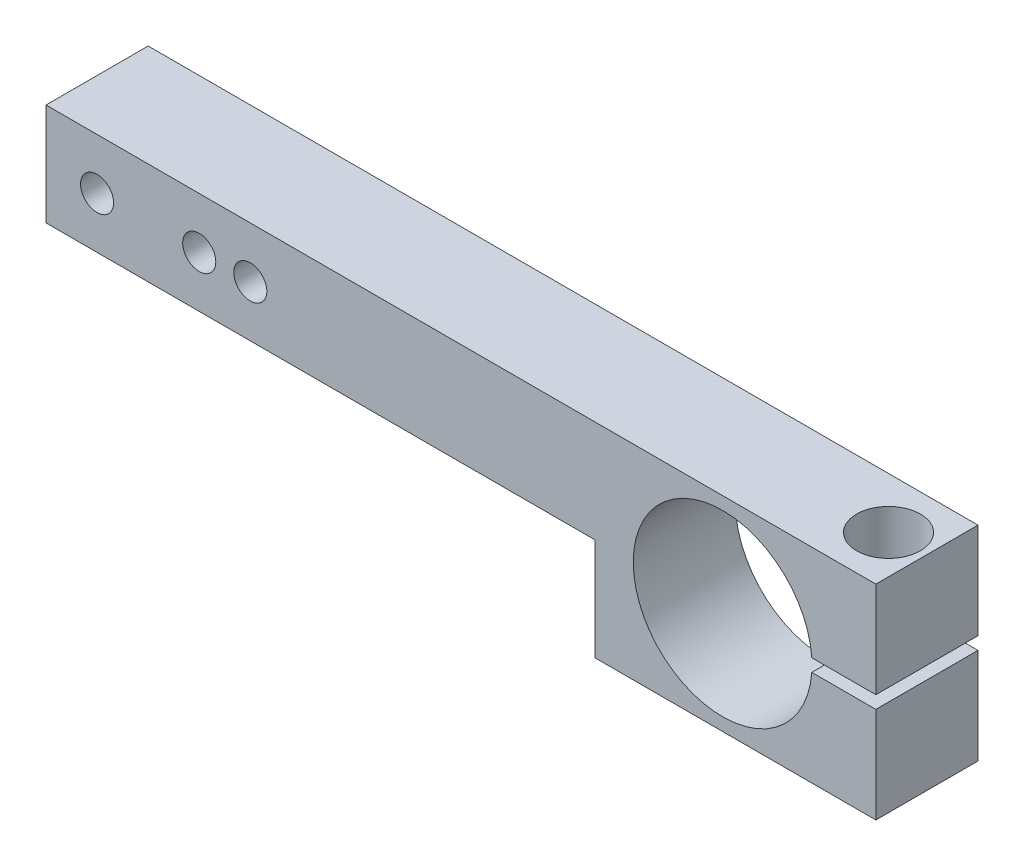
SolidWorks part; units mm, degrees
ref_plane "Front Plane" through (0, 0, 0) normal (0, 0, 1) x (1, 0, 0)
ref_plane "Top Plane" through (0, 0, 0) normal (0, 1, 0) x (1, 0, 0)
ref_plane "Right Plane" through (0, 0, 0) normal (1, 0, 0) x (0, 0, -1)
sketch "Sketch1" plane through (0, 0, 0) normal (0, 0, 1) x (1, 0, 0)
  line L0 (0, 0) -> (11.1125, 0)
  line L1 (11.1125, 0) -> (19.05, 0)
  line L2 (19.05, 0) -> (19.05, 12.7)
  line L3 (19.05, 12.7) -> (-84.1248, 12.7)
  line L4 (-84.1248, 12.7) -> (-84.1248, -12.7)
  line L5 (-84.1248, -12.7) -> (19.05, -12.7)
  line L6 (19.05, -12.7) -> (19.05, 0)
  line L7 (0, 0) -> (-11.1125, 0) construction
  line L8 (14.2748, 12.7) -> (14.2748, 0)
  line L9 (14.2748, 0) -> (14.2748, -12.7)
  line L10 (-84.1248, 0) -> (-15.875, 0)
  line L11 (-15.875, 0) -> (-15.875, -12.7)
  circle A0 centre (0, 0) radius 11.1125
  circle A1 centre (-77.7748, 6.35) radius 2.0574
  circle A2 centre (-58.7248, 6.35) radius 2.0574
  circle A3 centre (-65.0748, 6.35) radius 2.0574
  dimension "D1" = 22.225
  dimension "D11" = 4.1148
  dimension "D2" = 25.4
  dimension "D3" = 19.05
  dimension "D4" = 4.7752
  dimension "D5" = 84.1248
  dimension "D6" = 12.7
  dimension "D7" = 15.875
  dimension "D8" = 6.35
  dimension "D9" = 19.05
  dimension "D10" = 6.35
  dimension "D12" = 103.1748
  dimension "D13" = 12.7
sketch "Sketch2" plane through (0, 0, 0) normal (0, 0, 1) x (1, 0, 0)
  line L0 (19.05, 0) -> (19.05, 12.7) construction
  line L1 (19.05, 12.7) -> (-84.1248, 12.7) construction
  line L2 (-84.1248, 12.7) -> (-84.1248, -12.7) construction
  line L3 (-84.1248, -12.7) -> (19.05, -12.7) construction
  line L4 (19.05, -12.7) -> (19.05, 0) construction
  line L5 (-84.1248, 0) -> (-15.875, 0) construction
  line L6 (-15.875, 0) -> (-15.875, -12.7) construction
  line L7 (19.05, 0) -> (19.05, 12.7)
  line L8 (19.05, 12.7) -> (-84.1248, 12.7)
  line L9 (-84.1248, 12.7) -> (-84.1248, 0)
  line L10 (-15.875, -12.7) -> (19.05, -12.7)
  line L11 (19.05, -12.7) -> (19.05, 0)
  line L12 (-84.1248, 0) -> (-15.875, 0)
  line L13 (-15.875, 0) -> (-15.875, -12.7)
  circle A0 centre (0, 0) radius 11.1125 construction
  circle A1 centre (0, 0) radius 11.1125
  circle A2 centre (-77.7748, 6.35) radius 2.0574 construction
  circle A3 centre (-58.7248, 6.35) radius 2.0574 construction
  circle A4 centre (-77.7748, 6.35) radius 2.0574
  circle A5 centre (-58.7248, 6.35) radius 2.0574
  circle A6 centre (-65.0748, 6.35) radius 2.0574 construction
  circle A7 centre (-65.0748, 6.35) radius 2.0574
extrude "Boss-Extrude1" add sketch "Sketch2" along normal mid plane 12.7
hole_wizard "CBORE for #10 Socket Head Cap Screw1" positions "Sketch4" profile "Sketch3" counterbore size "#10" standard "ANSI Inch"
sketch "Sketch4" plane through (0, 12.7, 0) normal (0, 1, 0) x (1, 0, 0)
  point P0 (14.2748, 0)
sketch "Sketch3" plane through (14.2748, 12.7, 0) normal (1, 0, 0) x (0, 0, 1)
  line L0 (0, 0) -> (0, 25.4)
  line L1 (0, 25.4) -> (2.3876, 25.4)
  line L3 (2.3876, 25.4) -> (2.3876, 6.35)
  line L4 (2.3876, 6.35) -> (3.9624, 6.35)
  line L5 (3.9624, 6.35) -> (3.9624, 0)
  line L7 (3.9624, 0) -> (0, 0)
  line L11 (0, -6.35) -> (0, 107.95) construction
  dimension "Thru Hole Dia." = 4.7752
  dimension "Thru Hole Depth" = 25.4
  dimension "C'Bore Dia." = 7.9248
  dimension "C'Bore Depth" = 6.35
sketch "Sketch5" plane through (0, 0, 0) normal (0, 0, 1) x (1, 0, 0)
  line L0 (11.1125, 0) -> (19.05, 0) construction
  line L1 (0, 0) -> (11.1125, 0) construction
  line L2 (11.1125, 0) -> (19.05, 0)
  line L3 (0, 0) -> (11.1125, 0)
extrude "Cut-Extrude-Thin1" cut sketch "Sketch5" against normal through all and the other way through all thin
